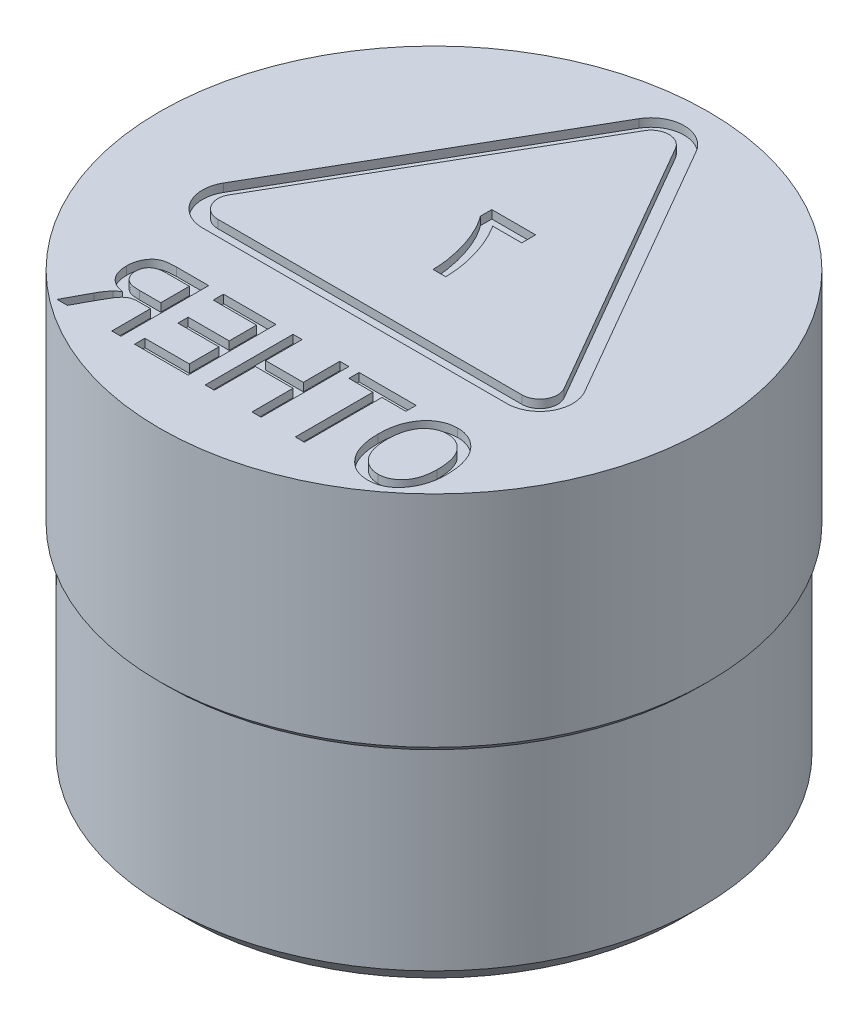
SolidWorks part; units mm, degrees
ref_plane "Front Plane" through (0, 0, 0) normal (0, 0, 1) x (1, 0, 0)
ref_plane "Top Plane" through (0, 0, 0) normal (0, 1, 0) x (1, 0, 0)
ref_plane "Right Plane" through (0, 0, 0) normal (1, 0, 0) x (0, 0, -1)
sketch "Sketch1" plane through (0, 0, 0) normal (0, 0, 1) x (1, 0, 0)
  line L0 (-10, 16) -> (-10, 8)
  line L1 (-10, 8) -> (-9.745, 7.745)
  line L2 (-9.745, 7.745) -> (-9.745, 0)
  line L3 (-9.745, 0) -> (0, 0)
  line L4 (0, 0) -> (0, 16)
  line L5 (0, 16) -> (-10, 16)
  line L6 (0, 36.7698) -> (0, -15.8595) construction
  dimension "D1" = 20
  dimension "D2" = 16
  dimension "D3" = 8
  dimension "D4" = 19.49
  dimension "D5" = 45
revolve "Revolve1" add sketch "Sketch1" angle 360 about L6
chamfer "Chamfer1" distance 0.76 angle 45 1 edges at (0, 0, 9.745)
hole_wizard "M6x1.0 Tapped Hole1" positions "Sketch4" profile "Sketch5" tap size "M6x1.0" standard "ANSI Metric"
sketch "Sketch4" plane through (0, 0, 0) normal (0, -1, 0) x (-1, 0, 0)
  point P0 (0, 0)
sketch "Sketch5" plane through (0, 0, 0) normal (1, 0, 0) x (0, 0, -1)
  line L0 (0, 0) -> (0, 6)
  line L1 (0, 6) -> (2.5, 6)
  line L2 (2.5, 6) -> (2.5, 0)
  line L5 (2.5, 0) -> (0, 0)
  line L10 (0, 6) -> (-2.5, 6) construction
  line L11 (0, -6.35) -> (0, 107.95) construction
  dimension "Tap Drill Dia." = 5
  dimension "Tap Drill Depth" = 6
  dimension "Drill Angle" = 180
sketch "Sketch8" plane through (0, 16, 0) normal (0, 1, 0) x (1, 0, 0)
  line L0 (-6.5846, -1.0921) -> (-1.0392, 8.5168)
  line L1 (-0.5606, 8.2377) -> (-6.1059, -1.3631)
  line L2 (-5.543, -2.3381) -> (5.5463, -2.3396)
  line L3 (6.1092, -1.3646) -> (0.5653, 8.2377)
  line L4 (1.0392, 8.5168) -> (6.5855, -1.0896)
  line L5 (5.5463, -2.8896) -> (-5.5454, -2.8921)
  arc A0 (1.0392, 8.5168) -> (-1.0392, 8.5168) centre (0, 7.9168) ccw
  arc A1 (0.5653, 8.2377) -> (-0.5606, 8.2377) centre (0.0024, 7.9127) ccw
  arc A2 (-6.1059, -1.3631) -> (-5.543, -2.3381) centre (-5.543, -1.6881) ccw
  arc A3 (-6.5846, -1.0921) -> (-5.5454, -2.8921) centre (-5.5454, -1.6921) ccw
  arc A4 (5.5463, -2.3396) -> (6.1092, -1.3646) centre (5.5463, -1.6896) ccw
  arc A5 (5.5463, -2.8896) -> (6.5855, -1.0896) centre (5.5463, -1.6896) ccw
  point P49 (0, 9.1168)
  point P50 (-6.7454, -1.6921)
  point P51 (6.7463, -1.6896)
  dimension "D2" = 1.2
  dimension "D3" = 0.65
  dimension "D13" = 1.2
  dimension "D14" = 0.65
extrude "Cut-Extrude2" cut sketch "Sketch8" against normal blind 0.3
sketch "Sketch12" plane through (0, 16, 0) normal (0, 1, 0) x (1, 0, 0)
  line L0 (0, 0) -> (0, 0.5402) construction
  line L1 (0, 0) -> (0.8877, 0) construction
  line L2 (0.0024, 8.5627) -> (0.0024, -1.1688) construction
  arc A0 (0.5653, 8.2377) -> (-0.5606, 8.2377) centre (0.0024, 7.9127) ccw construction
  text T0 "<b>7</b>" font "Arial Narrow" height 3
  dimension "D1" = 0.9
  dimension "D2" = 0
extrude "Cut-Extrude3" cut sketch "Sketch12" against normal blind 0.3
sketch "Sketch13" plane through (0, 16, 0) normal (0, 1, 0) x (1, 0, 0)
  text T0 "OTHER" font "Arial Narrow" height 3.2
  dimension "D1" = 7.8
  dimension "D2" = 6.9
extrude "Cut-Extrude4" cut sketch "Sketch13" against normal blind 0.3
